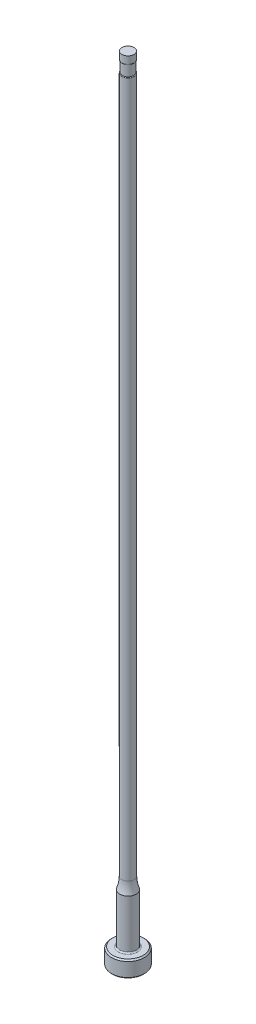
SolidWorks part; units mm, degrees
ref_plane "Front Plane" through (0, 0, 0) normal (0, 0, 1) x (1, 0, 0)
ref_plane "Top Plane" through (0, 0, 0) normal (0, 1, 0) x (1, 0, 0)
ref_plane "Right Plane" through (0, 0, 0) normal (1, 0, 0) x (0, 0, -1)
other "Configuration Table"
sketch "Sketch1" plane through (0, 0, 0) normal (0, 0, 1) x (1, 0, 0)
  line L0 (0, 259.9588) -> (0, -15.1925) construction
  line L1 (0, 0) -> (-3.175, 0)
  line L2 (-3.175, 0) -> (-3.175, 3.175)
  line L3 (-3.175, 3.175) -> (-1.5875, 3.175)
  line L4 (-1.19, 14.9114) -> (-1.19, 152.4)
  line L5 (-1.19, 152.4) -> (0, 152.4)
  line L6 (0, 152.4) -> (0, 0)
  line L7 (-1.5875, 3.175) -> (-1.5875, 12.7)
  arc A1 (-1.5875, 12.7) -> (-1.19, 14.9114) centre (-7.54, 14.9114) ccw
  dimension "D1" = 6.35
  dimension "L" = 152.4
  dimension "D2" = 3.175
  dimension "H" = 6.35
  dimension "T" = 3.175
  dimension "D" = 2.38
  dimension "S" = 12.7
revolve "Revolve1" add sketch "Sketch1" angle 360 about L0
chamfer "Chamfer1" distance 0.254 angle 45 2 edges at (0, 3.175, 3.175) (0, 0, 3.175)
fillet "Fillet1" radius 0.254 1 edges at (0, 3.175, 1.5875)
sketch "Sketch2" plane through (0, 0, 0) normal (0, 0, 1) x (1, 0, 0)
  line L0 (-1.19, 152.4) -> (-1.19, 14.9114) construction
  line L1 (-1.19, 150.876) -> (-1.0884, 150.876)
  line L2 (-1.19, 150.876) -> (-1.19, 148.844)
  line L3 (-1.19, 148.844) -> (-1.0884, 148.844)
  line L4 (-1.0884, 150.876) -> (-1.0884, 148.844)
  line L5 (1.19, 152.4) -> (-1.19, 152.4) construction
  line L6 (0, 153.4483) -> (0, 147.3282) construction
  dimension "D1" = 2.032
  dimension "N" = 1.524
  dimension "FD" = 0.1016
  dimension "D3" = 2.1768
revolve "Vent Relief" cut sketch "Sketch2" angle 360 about L6
sketch "Sketch3" plane through (0, 0, 0) normal (0, 0, 1) x (1, 0, 0)
  line L0 (-1.0884, 149.86) -> (-1.0884, 111.76)
  line L1 (-1.0884, 150.876) -> (-1.0884, 148.844) construction
  line L2 (-1.19, 148.844) -> (-1.19, 14.9114) construction
  line L3 (-1.19, 110.9632) -> (-1.19, 149.86)
  line L4 (-1.19, 149.86) -> (-1.0884, 149.86)
  arc A0 (-1.0884, 111.76) -> (-1.19, 110.9632) centre (-4.2634, 111.76) cw
  dimension "D1" = 3.175
  dimension "D2" = 38.1
extrude "D-Slot" cut sketch "Sketch3" against normal through all both and the other way through all
sketch "Sketch5" plane through (0, 0, 0) normal (0, 0, 1) x (1, 0, 0)
  line L0 (-1.19, 150.876) -> (1.19, 150.876) construction
  line L1 (-1.19, 152.4) -> (-1.1646, 152.4)
  line L2 (-1.19, 152.4) -> (-1.19, 150.876)
  line L3 (-1.19, 150.876) -> (-1.1646, 150.876)
  line L4 (-1.1646, 152.4) -> (-1.1646, 150.876)
  line L5 (0, 152.6877) -> (0, 150.5771) construction
  dimension "VP" = 0.0254
revolve "Vent Diameter" cut sketch "Sketch5" angle 360 about L5
fillet "Fillet2" radius 0.127 2 edges at (1.19, 148.844, 0) (0, 150.876, 1.1646)
sketch "Pocket Sketch" plane through (0, 0, 0) normal (0, 0, 1) x (1, 0, 0)
  line L0 (-3.5719, 0) -> (-3.5719, 3.2004)
  line L1 (-3.5719, 3.2004) -> (-2.1504, 3.2004)
  line L2 (-1.3884, 3.9624) -> (-1.3884, 22.225)
  line L3 (-1.3884, 22.225) -> (0, 22.225)
  line L4 (0, 22.225) -> (0, 0)
  line L5 (0, 0) -> (-3.5719, 0)
  line L6 (0, 12.6104) -> (0, -2.4989) construction
  line L7 (-3.175, 2.921) -> (-3.175, 0.254) construction
  line L8 (2.921, 3.175) -> (-2.921, 3.175) construction
  line L9 (-1.19, 110.9632) -> (-1.19, 14.9114) construction
  line L10 (-2.1504, 3.2004) -> (-1.3884, 3.9624)
  point P3 (-1.3884, 3.2004)
  dimension "D1" = 7.1437
  dimension "D2" = 0.3969
  dimension "D3" = 0.0254
  dimension "D4" = 0.1984
  dimension "D5" = 2.7769
  dimension "D6" = 22.225
